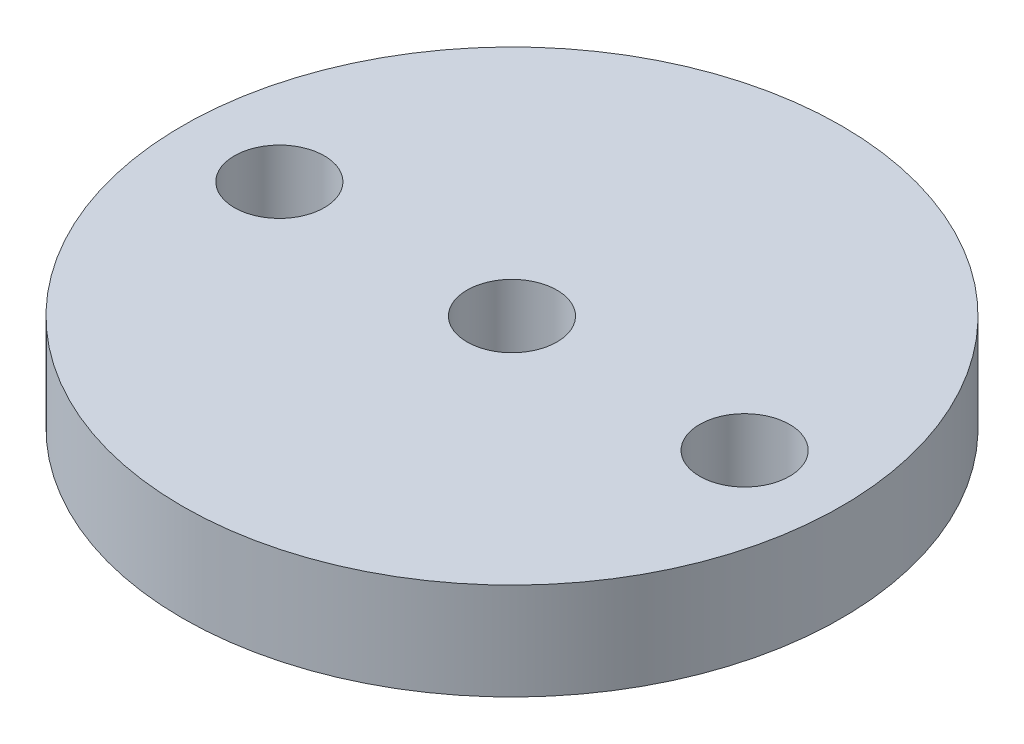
SolidWorks part; units mm, degrees
ref_plane "Front Plane" through (0, 0, 0) normal (0, 0, 1) x (1, 0, 0)
ref_plane "Top Plane" through (0, 0, 0) normal (0, 1, 0) x (1, 0, 0)
ref_plane "Right Plane" through (0, 0, 0) normal (1, 0, 0) x (0, 0, -1)
sketch "Sketch1" plane through (0, 0, 0) normal (0, 1, 0) x (1, 0, 0)
  line L0 (-52.8667, 0) -> (50.5636, 0) construction
  line L7 (0, 64.4869) -> (0, -49.412) construction
  circle A0 centre (0, 0) radius 10.795
  dimension "D1" = 21.59
extrude "Boss-Extrude1" add sketch "Sketch1" along normal blind 3.175
hole_wizard "#4 Clearance Hole1" positions "Sketch4" profile "Sketch2" hole size "#4" standard "ANSI Inch"
sketch "Sketch4" plane through (0, 3.175, 0) normal (0, 1, 0) x (1, 0, 0)
  circle A1 centre (0, 0) radius 7.62 construction
  point P61 (-7.62, 0)
  point P63 (7.62, 0)
  point P83 (0, 0)
  dimension "D3" = 15.24
sketch "Sketch2" plane through (-7.62, 3.175, 0) normal (1, 0, 0) x (0, 0, 1)
  line L0 (0, 0) -> (0, 3.175)
  line L1 (0, 3.175) -> (1.4732, 3.175)
  line L2 (1.4732, 3.175) -> (1.4732, 0)
  line L5 (1.4732, 0) -> (0, 0)
  line L11 (0, -6.35) -> (0, 107.95) construction
  dimension "Thru Hole Dia." = 2.9464
  dimension "Thru Hole Depth" = 3.175
